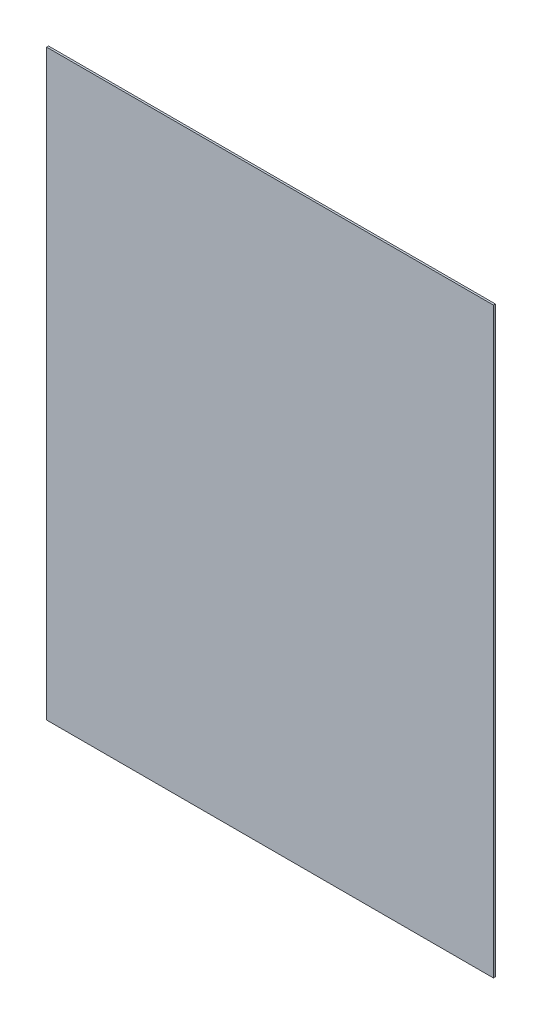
SolidWorks part; units mm, degrees
ref_plane "Płaszczyzna przednia" through (0, 0, 0) normal (0, 0, 1) x (1, 0, 0)
ref_plane "Płaszczyzna górna" through (0, 0, 0) normal (0, 1, 0) x (1, 0, 0)
ref_plane "Płaszczyzna prawa" through (0, 0, 0) normal (1, 0, 0) x (0, 0, -1)
sketch "Szkic1" plane through (0, 0, 0) normal (0, 0, 1) x (1, 0, 0)
  line L1 (-1360.6168, 40.0223) -> (939.3832, 40.0223)
  line L2 (-1360.6168, 40.0223) -> (-1360.6168, -2959.9777)
  line L3 (-1360.6168, -2959.9777) -> (939.3832, -2959.9777)
  line L4 (939.3832, 40.0223) -> (939.3832, -2959.9777)
  dimension "D1" = 2300
  dimension "D2" = 3000
extrude "Dodanie-wyciągnięcie1" add sketch "Szkic1" along normal blind 10
